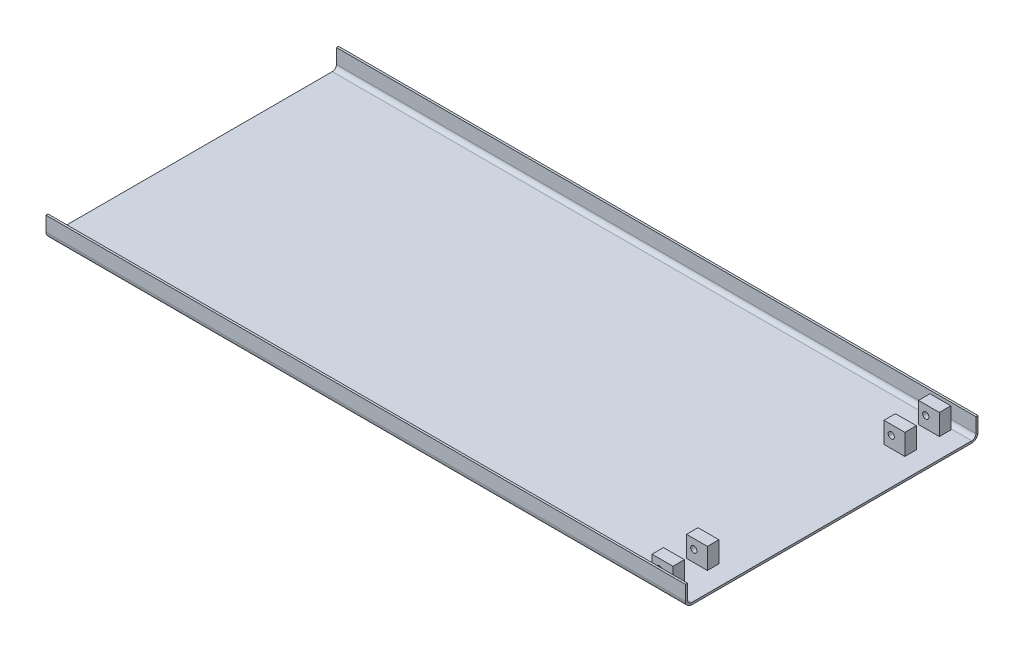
SolidWorks part; units mm, degrees
ref_plane "Front Plane" through (0, 0, 0) normal (0, 0, 1) x (1, 0, 0)
ref_plane "Top Plane" through (0, 0, 0) normal (0, 1, 0) x (1, 0, 0)
ref_plane "Right Plane" through (0, 0, 0) normal (1, 0, 0) x (0, 0, -1)
sketch "Sketch1" plane through (0, 0, 0) normal (1, 0, 0) x (0, 0, -1)
  line L0 (-670, 0) -> (670, 0)
  line L1 (700, 30) -> (700, 100)
  line L2 (0, 0) -> (0, 117.0863) construction
  line L3 (-700, 30) -> (-700, 100)
  arc A0 (-700, 30) -> (-670, 0) centre (-670, 30) ccw
  arc A1 (670, 0) -> (700, 30) centre (670, 30) ccw
  point P9 (-700, 0)
  point P12 (700, 0)
  dimension "D3" = 30
  dimension "D1" = 1400
  dimension "D2" = 100
extrude "Extrude-Thin1" add sketch "Sketch1" along normal mid plane 3060 thin
sketch "Sketch2" plane through (0, 10, 0) normal (0, 1, 0) x (1, 0, 0)
  line L0 (1530, 670) -> (1530, -670) construction
  line L1 (1435, -610) -> (1335, -610)
  line L2 (1435, -610) -> (1435, -665)
  line L3 (1435, -665) -> (1335, -665)
  line L4 (1335, -610) -> (1335, -665)
  line L5 (1530, -690) -> (-1530, -690) construction
  line L6 (1435, -445) -> (1335, -445)
  line L7 (1435, -500) -> (1335, -500)
  line L8 (1435, -445) -> (1435, -500)
  line L9 (1335, -445) -> (1335, -500)
  line L10 (0, 0) -> (363.236, 0) construction
  line L11 (1335, 445) -> (1335, 500)
  line L12 (1435, 445) -> (1435, 500)
  line L13 (1435, 500) -> (1335, 500)
  line L14 (1435, 445) -> (1335, 445)
  line L15 (1335, 610) -> (1335, 665)
  line L16 (1435, 665) -> (1335, 665)
  line L17 (1435, 610) -> (1435, 665)
  line L18 (1435, 610) -> (1335, 610)
  dimension "D1" = 100
  dimension "D2" = 55
  dimension "D3" = 95
  dimension "D4" = 25
  dimension "D5" = 100
  dimension "D6" = 55
extrude "Boss-Extrude1" add sketch "Sketch2" along normal blind 100 contours L1 L4 L3 L2 | L6 L9 L7 L8 | L14 L12 L13 L11 | L18 L17 L16 L15
sketch "Sketch3" plane through (0, 0, 665) normal (0, 0, 1) x (1, 0, 0)
  line L0 (1435, 110) -> (1435, 10) construction
  line L1 (1530, 0) -> (-1530, 0) construction
  circle A0 centre (1370, 65) radius 15
  dimension "D3" = 30
  dimension "D1" = 65
  dimension "D2" = 65
extrude "Cut-Extrude1" cut sketch "Sketch3" against normal up to surface (1330 mm away)
